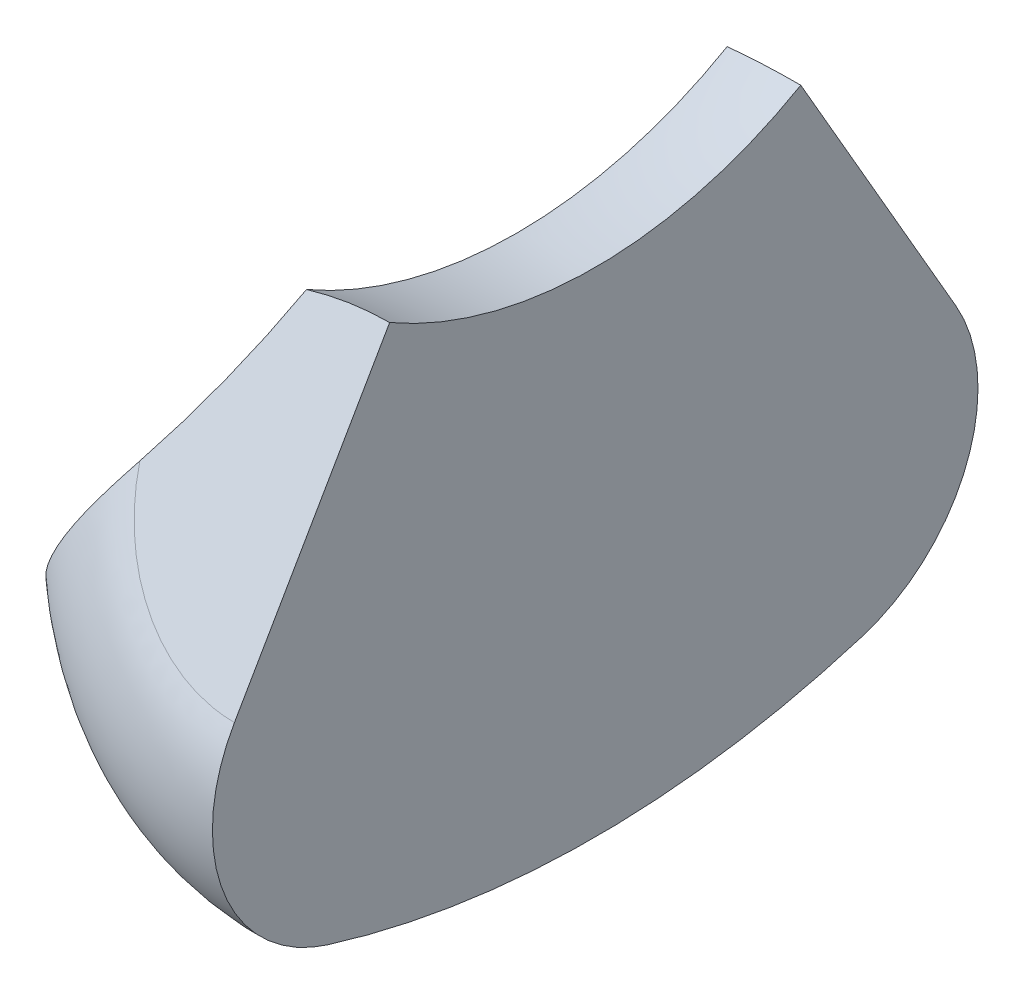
SolidWorks part; units mm, degrees
ref_plane "Plan1" through (0, 0, 0) normal (0, 0, 1) x (1, 0, 0)
ref_plane "Plan2" through (0, 0, 0) normal (0, 1, 0) x (1, 0, 0)
ref_plane "Plan3" through (0, 0, 0) normal (1, 0, 0) x (0, 0, -1)
sketch "Esquisse2" plane through (0, 0, 0) normal (0, 0, 1) x (1, 0, 0)
  line L1 (14.2, -5) -> (14.2, -11)
  line L5 (14.2, 11) -> (14.2, -11) construction
  line L7 (0, 0) -> (20, 0) construction
  circle A1 centre (0, 0) radius 14.2 construction
  arc A2 (10.8408, -9.1716) -> (13.2467, -5.1153) centre (0, 0) ccw
  arc A3 (14.2, -11) -> (10.8408, -9.1716) centre (14.2, -7) cw
  arc A5 (13.2467, -5.1153) -> (14.2, -5) centre (14.2, -9) cw
  arc A6 (14.2, -11) -> (25.2, -25) centre (42.6091, 0) ccw construction
  dimension "D1" = 4
  dimension "D2" = 6
  dimension "D3" = 4
revolve "Base-Révolution" add sketch "Esquisse2" angle 60 about L7
fillet "Congé1" radius 2
